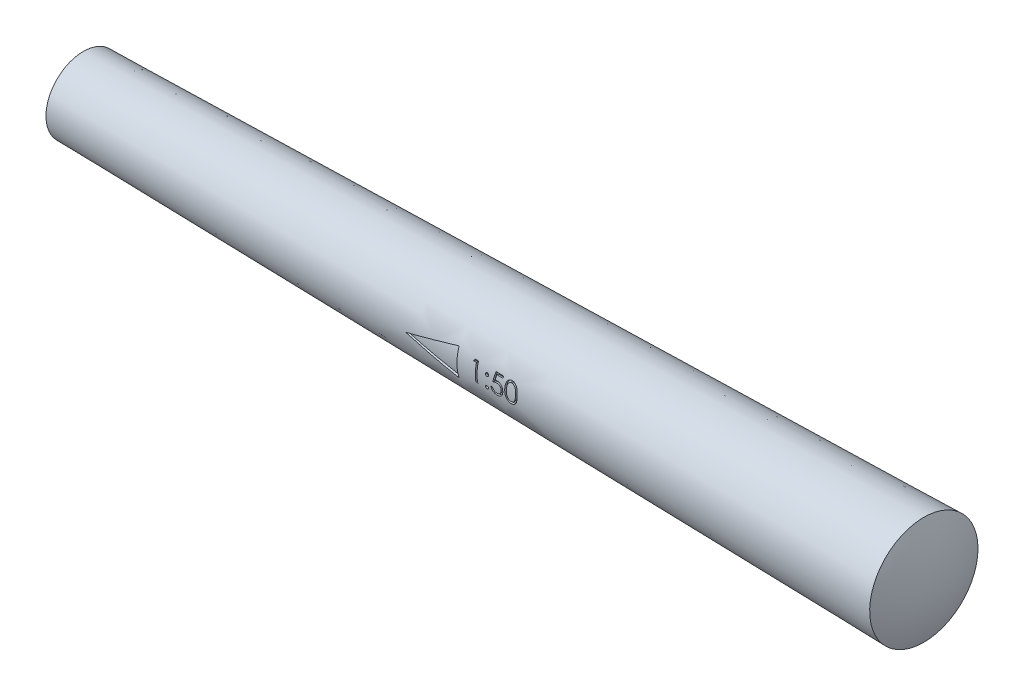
SolidWorks part; units mm, degrees
ref_plane "Front Plane" through (0, 0, 0) normal (0, 0, 1) x (1, 0, 0)
ref_plane "Top Plane" through (0, 0, 0) normal (0, 1, 0) x (1, 0, 0)
ref_plane "Right Plane" through (0, 0, 0) normal (1, 0, 0) x (0, 0, -1)
sketch "Sketch1" plane through (0, 0, 0) normal (1, 0, 0) x (0, 0, -1)
  circle A0 centre (0, 0) radius 2
  dimension "D1" = 4
extrude "Extrude1" add sketch "Sketch1" along normal mid plane 45
draft "Draft1" type of draft neutral plane draft angle 1.146 faces to draft 1 parameters "D1"=1.146
sketch "Sketch2" plane through (0, 0, 0) normal (0, 0, 1) x (1, 0, 0)
  line L0 (-22.5, 0) -> (-22.5, 2)
  line L1 (-22.5, 2) -> (-22.5, -2) construction
  line L2 (-22.5, 0) -> (-23.1, 0)
  line L3 (-23.1, 0) -> (-23.1, -2.45) construction
  line L4 (22.5, 0) -> (22.5, 2.9)
  line L5 (22.5, -2.9) -> (22.5, 2.9) construction
  line L6 (22.5, 0) -> (23.1, 0)
  line L7 (23.1, 0) -> (23.1, -2.45) construction
  line L8 (-22.5, -2) -> (22.5, -2.9) construction
  arc A0 (-23.1, 0) -> (-22.5, 2) centre (-19.4667, 0) cw
  arc A1 (23.1, 0) -> (22.5, 2.9) centre (15.7915, 0) ccw
  point P14 (0, -2.45)
revolve "Revolve1" add sketch "Sketch2" angle 360 about L2
sketch "Sketch5" plane through (0, 0, 0) normal (0, 0, 1) x (1, 0, 0)
  line L0 (0, 2.45) -> (0, -2.45) construction
  line L1 (22.5, 2.9) -> (-22.5, 2) construction
  line L2 (-22.5, -2) -> (22.5, -2.9) construction
ref_plane "Plane2" through (0, 0, 0) normal (-0.02, 0, 0.9998) x (0.9998, 0, 0.02)
sketch "Sketch6" plane through (0, 0, 0) normal (-0.02, 0, 0.9998) x (0.9998, 0, 0.02)
  line L0 (0, 0) -> (0, 0.75)
  line L1 (0, 2.45) -> (0, -2.45) construction
  line L2 (0, 0.75) -> (-2.799, 0)
  line L3 (-2.799, 0) -> (0, -0.75)
  line L4 (0, -0.75) -> (0, 0)
  line L5 (0, -0.375) -> (4, -0.375) construction
  text T0 "1:50" font "Century Gothic" height 1
  dimension "D1" = 1.5
  dimension "D2" = 30
  dimension "D3" = 4
wrap "Wrap2" sketch "Sketch6" wrap type deboss source sketch "Sketch6" thickness 0.1 parameters "D1"=0.1
equation "\"D2@Sketch2\" = \"D1@Sketch2\""
